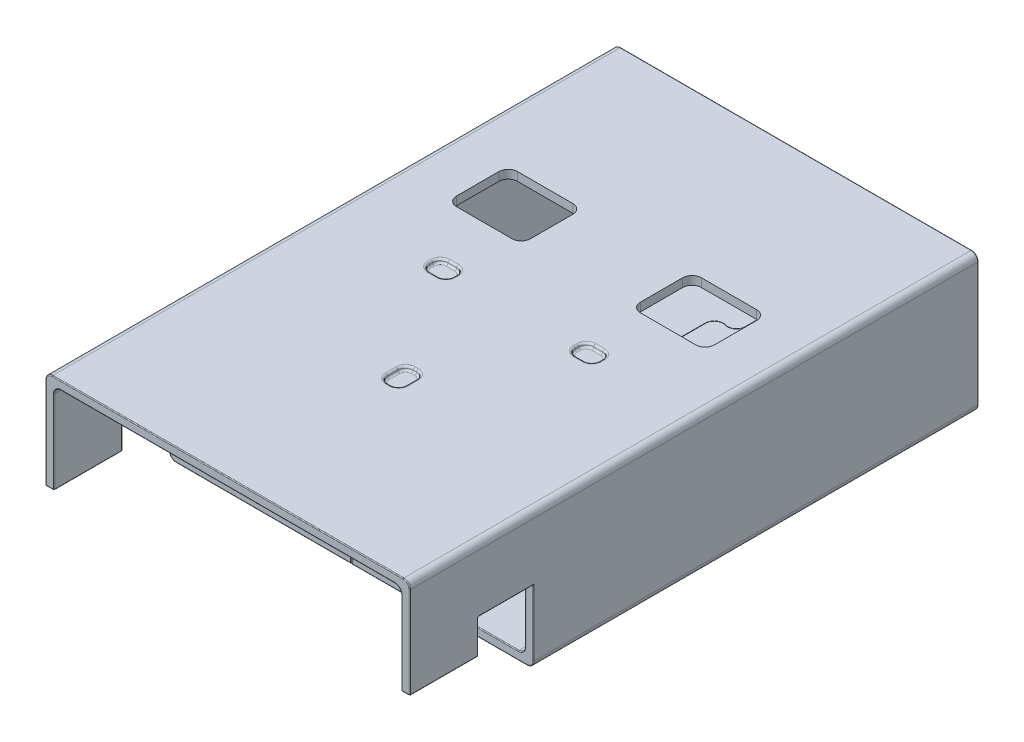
SolidWorks part; units mm, degrees
ref_plane "Front Plane" through (0, 0, 0) normal (0, 0, 1) x (1, 0, 0)
ref_plane "Top Plane" through (0, 0, 0) normal (0, 1, 0) x (1, 0, 0)
ref_plane "Right Plane" through (0, 0, 0) normal (1, 0, 0) x (0, 0, -1)
sketch "Sketch1" plane through (0, 0, 0) normal (0, 0, 1) x (1, 0, 0)
  line L1 (-6.0008, -2.2606) -> (6.0007, -2.2606)
  line L2 (-6.0008, -2.2606) -> (-6.0008, 2.2606)
  line L3 (-6.0008, 2.2606) -> (6.0007, 2.2606)
  line L4 (6.0007, -2.2606) -> (6.0007, 2.2606)
  line L5 (-6.0008, -2.2606) -> (6.0007, 2.2606) construction
  line L6 (-6.0008, 2.2606) -> (6.0007, -2.2606) construction
  point P0 (0, 0)
  point P6 (0, 0)
  dimension "D1" = 12.0015
  dimension "D2" = 4.5212
extrude "Extrude-Thin1" add sketch "Sketch1" along normal blind 18.7325 thin
sketch "Sketch2" plane through (0, 0, 0) normal (1, 0, 0) x (0, 0, -1)
  line L0 (-14.6558, -2.2606) -> (-14.6558, 0.1397)
  line L1 (-18.7325, -2.2606) -> (0, -2.2606) construction
  line L2 (-14.6558, 0.1397) -> (-16.4846, 0.1397)
  line L3 (-16.4846, 0.1397) -> (-16.4846, -0.9831)
  line L4 (-16.4846, -0.9831) -> (-18.7325, -0.9831)
  line L5 (-18.7325, 2.2606) -> (-18.7325, -2.2606) construction
  line L6 (-18.7325, -0.9831) -> (-18.7325, -2.2606)
  line L7 (-18.7325, -2.2606) -> (-14.6558, -2.2606)
  line L8 (0, 2.2606) -> (0, -2.2606) construction
  line L9 (-18.7325, 2.2606) -> (0, 2.2606) construction
  dimension "D1" = 14.6558
  dimension "D2" = 2.1209
  dimension "D3" = 2.2479
  dimension "D4" = 3.2437
extrude "Extrude1" cut sketch "Sketch2" against normal up to next and the other way up to next
sketch "Sketch3" plane through (0, -2.2606, 0) normal (0, -1, 0) x (1, 0, 0)
  line L0 (0, 0) -> (0, 1.6764)
  line L1 (-6.0008, 0) -> (6.0007, 0) construction
  line L2 (-0.762, 2.2352) -> (-0.762, 4.1148)
  line L3 (0, 6.35) -> (0, 4.6736)
  line L4 (-2.8416, 3.175) -> (2.0553, 3.175) construction
  line L5 (0, 7.874) -> (0, 9.5504)
  line L6 (-0.762, 10.1092) -> (-0.762, 11.9888)
  line L7 (0, 14.224) -> (0, 12.5476)
  line L8 (-2.8416, 11.049) -> (2.0553, 11.049) construction
  line L9 (-0.762, 3.175) -> (-0.762, 11.049) construction
  line L10 (0, 6.35) -> (0, 7.874)
  line L11 (0, 14.224) -> (0, 14.6558)
  line L12 (6.0007, 14.6558) -> (-6.0008, 14.6558) construction
  arc A0 (0, 1.6764) -> (-0.381, 1.9558) centre (-0.2929, 1.6764) ccw
  arc A1 (-0.381, 1.9558) -> (-0.762, 2.2352) centre (-0.4691, 2.2352) cw
  arc A2 (-0.381, 4.3942) -> (-0.762, 4.1148) centre (-0.4691, 4.1148) ccw
  arc A3 (0, 4.6736) -> (-0.381, 4.3942) centre (-0.2929, 4.6736) cw
  arc A4 (0, 9.5504) -> (-0.381, 9.8298) centre (-0.2929, 9.5504) ccw
  arc A5 (-0.381, 9.8298) -> (-0.762, 10.1092) centre (-0.4691, 10.1092) cw
  arc A6 (-0.381, 12.2682) -> (-0.762, 11.9888) centre (-0.4691, 11.9888) ccw
  arc A7 (0, 12.5476) -> (-0.381, 12.2682) centre (-0.2929, 12.5476) cw
  point P9 (-0.762, 3.175)
  point P25 (-0.762, 11.049)
  dimension "D1" = 0.5588
  dimension "D2" = 0.762
  dimension "D3" = 3.175
  dimension "D4" = 2.4384
  dimension "D5" = 7.874
extrude "Cut-Extrude-Thin1" cut sketch "Sketch3" against normal up to next thin
sketch "Sketch4" plane through (0, 2.2606, 0) normal (0, 1, 0) x (1, 0, 0)
  line L0 (0, 0) -> (0, -18.7325) construction
  line L1 (-3.9413, -5.2451) -> (-2.1166, -5.2451)
  line L2 (-4.2481, -5.5519) -> (-4.2481, -6.9449)
  line L3 (-3.9413, -7.2517) -> (-2.1166, -7.2517)
  line L4 (-1.8098, -5.5519) -> (-1.8098, -6.9449)
  line L5 (6.0007, -18.7325) -> (-6.0008, -18.7325) construction
  line L6 (1.8098, -5.5519) -> (1.8098, -6.9449)
  line L7 (3.9413, -7.2517) -> (2.1166, -7.2517)
  line L8 (4.2482, -5.5519) -> (4.2482, -6.9449)
  line L9 (3.9413, -5.2451) -> (2.1166, -5.2451)
  line L10 (6.0007, 0) -> (-6.0008, 0) construction
  line L11 (-6.0008, -18.7325) -> (-6.0008, 0) construction
  arc A0 (-3.9413, -5.2451) -> (-4.2481, -5.5519) centre (-3.9413, -5.5519) ccw
  arc A1 (-2.1166, -5.2451) -> (-1.8098, -5.5519) centre (-2.1166, -5.5519) cw
  arc A2 (-2.1166, -7.2517) -> (-1.8098, -6.9449) centre (-2.1166, -6.9449) ccw
  arc A3 (-4.2481, -6.9449) -> (-3.9413, -7.2517) centre (-3.9413, -6.9449) ccw
  arc A4 (4.2482, -6.9449) -> (3.9413, -7.2517) centre (3.9413, -6.9449) cw
  arc A5 (2.1166, -7.2517) -> (1.8098, -6.9449) centre (2.1166, -6.9449) cw
  arc A6 (2.1166, -5.2451) -> (1.8098, -5.5519) centre (2.1166, -5.5519) ccw
  arc A7 (3.9413, -5.2451) -> (4.2482, -5.5519) centre (3.9413, -5.5519) cw
  point P19 (-4.2482, -5.2451)
  point P22 (-1.8098, -5.2451)
  point P25 (-1.8098, -7.2517)
  point P28 (-4.2482, -7.2517)
  point P37 (4.2481, -7.2517)
  point P38 (1.8097, -7.2517)
  point P39 (1.8098, -5.2451)
  point P40 (4.2481, -5.2451)
  dimension "D5" = 0.3068
  dimension "D1" = 2.4384
  dimension "D2" = 2.0066
  dimension "D3" = 5.2451
  dimension "D4" = 1.7526
extrude "Extrude2" cut sketch "Sketch4" against normal through all
fillet "Fillet1" radius 0.2195 8 edges at (-6.0008, -2.2606, 7.3279) (6.0007, -2.2606, 7.3279) (6.0007, 2.2606, 9.3662) (-6.0008, 2.2606, 9.3662) (-5.7214, 1.9812, 9.3662) (-5.7214, -1.9812, 7.3279) (5.7213, -1.9812, 7.3279) (5.7213, 1.9812, 9.3662)
sketch "Sketch5" plane through (0, 2.2606, 0) normal (0, 1, 0) x (1, 0, 0)
  line L0 (0, 0) -> (0, -18.7325) construction
  line L1 (-2.5464, -8.9281) -> (-2.2585, -8.9281)
  line L2 (-2.8004, -9.1821) -> (-2.8004, -9.2837)
  line L3 (-2.5464, -9.5377) -> (-2.2585, -9.5377)
  line L4 (-2.0045, -9.1821) -> (-2.0045, -9.2837)
  line L5 (5.7813, -18.7325) -> (-5.7813, -18.7325) construction
  line L6 (-6.0008, -18.7325) -> (-6.0008, 0) construction
  line L7 (-0.055, -12.5645) -> (0.055, -12.5645)
  line L8 (-0.309, -12.8185) -> (-0.309, -13.1572)
  line L9 (-0.055, -13.4112) -> (0.055, -13.4112)
  line L10 (0.309, -12.8185) -> (0.309, -13.1572)
  line L11 (-0.309, -12.5645) -> (0.309, -13.4112) construction
  line L12 (-0.309, -13.4112) -> (0.309, -12.5645) construction
  line L13 (-3.9413, -7.2517) -> (-2.1166, -7.2517) construction
  line L14 (2.0045, -9.1821) -> (2.0045, -9.2837)
  line L15 (2.5464, -9.5377) -> (2.2585, -9.5377)
  line L16 (2.8004, -9.1821) -> (2.8004, -9.2837)
  line L17 (2.5464, -8.9281) -> (2.2585, -8.9281)
  arc A0 (-2.5464, -8.9281) -> (-2.8004, -9.1821) centre (-2.5464, -9.1821) ccw
  arc A1 (-2.2585, -8.9281) -> (-2.0045, -9.1821) centre (-2.2585, -9.1821) cw
  arc A2 (-2.2585, -9.5377) -> (-2.0045, -9.2837) centre (-2.2585, -9.2837) ccw
  arc A3 (-2.8004, -9.2837) -> (-2.5464, -9.5377) centre (-2.5464, -9.2837) ccw
  arc A4 (-0.055, -12.5645) -> (-0.309, -12.8185) centre (-0.055, -12.8185) ccw
  arc A5 (0.055, -12.5645) -> (0.309, -12.8185) centre (0.055, -12.8185) cw
  arc A6 (0.055, -13.4112) -> (0.309, -13.1572) centre (0.055, -13.1572) ccw
  arc A7 (-0.309, -13.1572) -> (-0.055, -13.4112) centre (-0.055, -13.1572) ccw
  arc A8 (2.8004, -9.2837) -> (2.5464, -9.5377) centre (2.5464, -9.2837) cw
  arc A9 (2.2585, -9.5377) -> (2.0045, -9.2837) centre (2.2585, -9.2837) cw
  arc A10 (2.2585, -8.9281) -> (2.0045, -9.1821) centre (2.2585, -9.1821) ccw
  arc A11 (2.5464, -8.9281) -> (2.8004, -9.1821) centre (2.5464, -9.1821) cw
  point P9 (0, -12.9879)
  point P22 (-2.0045, -8.9281)
  point P25 (-2.0045, -9.5377)
  point P28 (-2.8004, -9.5377)
  point P53 (2.8004, -9.5377)
  point P54 (2.0045, -9.5377)
  point P55 (2.0045, -8.9281)
  dimension "D8" = 0.254
  dimension "D1" = 0.8467
  dimension "D2" = 5.3213
  dimension "D3" = 0.6181
  dimension "D4" = 3.2004
  dimension "D5" = 1.6764
  dimension "D6" = 0.6096
  dimension "D7" = 0.7959
extrude "Extrude3" cut sketch "Sketch5" against normal blind 0.127
fillet "Fillet3" radius 0.0635 48 edges at (0.309, 2.1336, 12.9879) (0.2346, 2.1336, 13.3368) (0, 2.1336, 13.4112) (-0.2346, 2.1336, 13.3368) (-0.309, 2.1336, 12.9879) (-0.2346, 2.1336, 12.6389) (0, 2.1336, 12.5645) (0.309, 2.2606, 12.9879) (0.2346, 2.2606, 13.3368) (0, 2.2606, 13.4112) (-0.2346, 2.2606, 13.3368) (-0.309, 2.2606, 12.9879) (-0.2346, 2.2606, 12.6389) (0, 2.2606, 12.5645) (2.726, 2.2606, 9.0025) (2.8004, 2.2606, 9.2329) (2.726, 2.2606, 9.4633) (2.4024, 2.2606, 9.5377) (2.0789, 2.2606, 9.4633) (2.0045, 2.2606, 9.2329) (2.0789, 2.2606, 9.0025) (2.726, 2.1336, 9.0025) (2.8004, 2.1336, 9.2329) (2.726, 2.1336, 9.4633) (2.4024, 2.1336, 9.5377) (2.0789, 2.1336, 9.4633) (2.0045, 2.1336, 9.2329) (2.0789, 2.1336, 9.0025) (-2.0045, 2.1336, 9.2329) (-2.0789, 2.1336, 9.4633) (-2.4024, 2.1336, 9.5377) (-2.726, 2.1336, 9.4633) (-2.8004, 2.1336, 9.2329) (-2.726, 2.1336, 9.0025) (-2.4024, 2.1336, 8.9281) (-2.0789, 2.2606, 9.0025) (-2.0045, 2.2606, 9.2329) (-2.0789, 2.2606, 9.4633) (-2.4024, 2.2606, 9.5377) (-2.726, 2.2606, 9.4633) (-2.8004, 2.2606, 9.2329) (-2.726, 2.2606, 9.0025) (0.2346, 2.1336, 12.6389) (0.2346, 2.2606, 12.6389) (2.4024, 2.2606, 8.9281) (2.4024, 2.1336, 8.9281) (-2.0789, 2.1336, 9.0025) (-2.4024, 2.2606, 8.9281)
sketch "Sketch6" plane through (0, -2.2606, 0) normal (0, -1, 0) x (1, 0, 0)
  line L12 (-0.0444, 2.2162) -> (-0.0444, 4.1338)
  line L13 (-0.0444, 10.0902) -> (-0.0444, 12.0078)
  line L20 (0.1333, 0.127) -> (5.6543, 0.127)
  line L21 (5.6543, 0.127) -> (5.6543, 14.5288)
  line L22 (5.6543, 14.5288) -> (0.1334, 14.5288)
  line L23 (0.1334, 14.5288) -> (0.1333, 12.5476)
  line L24 (-0.6287, 11.9888) -> (-0.6287, 10.1092)
  line L25 (0.1333, 9.5504) -> (0.1333, 4.6736)
  line L26 (-0.6286, 4.1148) -> (-0.6287, 2.2352)
  line L27 (0.1334, 1.6764) -> (0.1333, 0.127)
  line L32 (-0.6287, 11.9888) -> (-0.6287, 10.1092)
  line L34 (-0.6286, 4.1148) -> (-0.6287, 2.2352)
  arc A24 (-0.0444, 2.2162) -> (-0.1993, 2.0923) centre (-0.1714, 2.2162) cw
  arc A25 (-0.0444, 4.1338) -> (-0.1993, 4.2577) centre (-0.1714, 4.1338) ccw
  arc A26 (-0.0444, 12.0078) -> (-0.1993, 12.1317) centre (-0.1714, 12.0078) ccw
  arc A27 (-0.0444, 10.0902) -> (-0.1993, 9.9663) centre (-0.1714, 10.0902) cw
  arc A32 (-0.4211, 12.141) -> (0.1333, 12.5476) centre (-0.2929, 12.5476) ccw
  arc A33 (-0.4211, 12.141) -> (-0.6287, 11.9888) centre (-0.4691, 11.9888) ccw
  arc A34 (-0.6287, 10.1092) -> (-0.4211, 9.957) centre (-0.4691, 10.1092) ccw
  arc A35 (0.1333, 9.5504) -> (-0.4211, 9.957) centre (-0.2929, 9.5504) ccw
  arc A36 (-0.4211, 4.267) -> (0.1333, 4.6736) centre (-0.2929, 4.6736) ccw
  arc A37 (-0.4211, 4.267) -> (-0.6286, 4.1148) centre (-0.4691, 4.1148) ccw
  arc A38 (-0.6287, 2.2352) -> (-0.4211, 2.083) centre (-0.4691, 2.2352) ccw
  arc A39 (0.1334, 1.6764) -> (-0.4211, 2.083) centre (-0.2929, 1.6764) ccw
  arc A40 (-0.4211, 12.141) -> (-0.1993, 12.1317) centre (-0.2929, 12.5476) ccw
  arc A41 (-0.4211, 12.141) -> (-0.6287, 11.9888) centre (-0.4691, 11.9888) ccw
  arc A42 (-0.6287, 10.1092) -> (-0.4211, 9.957) centre (-0.4691, 10.1092) ccw
  arc A43 (-0.1993, 9.9663) -> (-0.4211, 9.957) centre (-0.2929, 9.5504) ccw
  arc A44 (-0.4211, 4.267) -> (-0.1993, 4.2577) centre (-0.2929, 4.6736) ccw
  arc A45 (-0.4211, 4.267) -> (-0.6286, 4.1148) centre (-0.4691, 4.1148) ccw
  arc A46 (-0.6287, 2.2352) -> (-0.4211, 2.083) centre (-0.4691, 2.2352) ccw
  arc A47 (-0.1993, 2.0923) -> (-0.4211, 2.083) centre (-0.2929, 1.6764) ccw
  dimension "D2" = 0.127
  dimension "D3" = 0.5842
  dimension "D1" = 0.127
extrude "Extrude4" cut sketch "Sketch6" against normal blind 0.0508
fillet "Fillet4" radius 0.0254 32 edges at (-0.5634, -2.2606, 4.2435) (-0.3108, -2.2606, 4.2477) (-0.0921, -2.2606, 4.233) (-0.0444, -2.2606, 3.175) (-0.0921, -2.2606, 2.117) (-0.3108, -2.2606, 2.1023) (-0.5634, -2.2606, 2.1065) (-0.5634, -2.2606, 12.1175) (-0.3108, -2.2606, 12.1217) (-0.0921, -2.2606, 12.107) (-0.0444, -2.2606, 11.049) (-0.0921, -2.2606, 9.991) (-0.3108, -2.2606, 9.9763) (-0.5634, -2.2606, 9.9805) (-0.3108, -2.2098, 2.1023) (-0.5634, -2.2098, 2.1065) (-0.6287, -2.2098, 3.175) (-0.5634, -2.2098, 4.2435) (-0.3108, -2.2098, 4.2477) (-0.0921, -2.2098, 4.233) (-0.0444, -2.2098, 3.175) (-0.0921, -2.2098, 2.117) (-0.0444, -2.2098, 11.049) (-0.0921, -2.2098, 9.991) (-0.3108, -2.2098, 9.9763) (-0.5634, -2.2098, 9.9805) (-0.6287, -2.2098, 11.049) (-0.5634, -2.2098, 12.1175) (-0.3108, -2.2098, 12.1217) (-0.0921, -2.2098, 12.107) (-0.6287, -2.2606, 3.175) (-0.6287, -2.2606, 11.049)
fillet "Fillet5" radius 0.0254 26 edges at (-0.0064, -2.2606, 13.6017) (-0.1235, -2.2606, 12.3165) (-0.646, -2.2606, 12.2302) (-0.7684, -2.2606, 11.049) (-0.646, -2.2606, 9.8678) (-0.1235, -2.2606, 9.7815) (-0.0064, -2.2606, 7.112) (-0.1235, -2.2606, 4.4425) (-0.646, -2.2606, 4.3562) (-0.7684, -2.2606, 3.175) (-0.646, -2.2606, 1.9938) (-0.1235, -2.2606, 1.9075) (0.0063, -2.2606, 13.6017) (-0.116, -2.2606, 12.3062) (-0.6385, -2.2606, 12.2199) (-0.7557, -2.2606, 11.049) (-0.6385, -2.2606, 9.8781) (-0.116, -2.2606, 9.7918) (0.0063, -2.2606, 7.112) (-0.116, -2.2606, 4.4322) (-0.6385, -2.2606, 4.3459) (-0.7557, -2.2606, 3.175) (-0.6385, -2.2606, 2.0041) (-0.116, -2.2606, 1.9178) (-0.0064, -2.2606, 0.8382) (0.0063, -2.2606, 0.8382)
fillet "Fillet6" radius 0.0254 100 edges at (2.7541, -1.9812, 0) (5.6571, -1.9169, 0) (-2.7541, -1.9812, 0) (-5.6571, -1.9169, 0) (-5.7214, 0, 0) (-5.6571, 1.9169, 0) (0, 1.9812, 0) (5.6571, 1.9169, 0) (0.0063, -2.1082, 0) (0.0138, -2.2532, 0) (2.9065, -2.2606, 0) (5.9365, -2.1963, 0) (-0.0064, -2.1082, 0) (-0.0138, -2.2532, 0) (-2.9065, -2.2606, 0) (-5.9365, -2.1963, 0) (-6.0008, 0, 0) (-5.9365, 2.1963, 0) (0, 2.2606, 0) (5.9365, 2.1963, 0) (5.7213, 0, 0) (6.0007, 0, 0) (5.7213, -0.811, 14.6558) (5.6571, -1.9169, 14.6558) (-2.7541, -1.9812, 14.6558) (-5.6571, -1.9169, 14.6558) (-0.0064, -2.1082, 14.6558) (-0.0138, -2.2532, 14.6558) (-6.0008, -0.9507, 14.6558) (-5.9365, -2.1963, 14.6558) (5.7213, 0.3893, 18.7325) (5.6571, 1.9169, 18.7325) (-5.7214, 0.3893, 18.7325) (-5.6571, 1.9169, 18.7325) (-6.0008, 0.529, 18.7325) (-5.9365, 2.1963, 18.7325) (0, 2.2606, 18.7325) (5.9365, 2.1963, 18.7325) (6.0007, -0.9507, 14.6558) (5.9365, -2.1963, 14.6558) (0.0063, -2.1082, 14.6558) (0.0138, -2.2532, 14.6558) (-4.1583, -1.9812, 7.1618) (-4.2482, -1.9812, 6.2484) (-4.1583, -1.9812, 5.335) (-3.029, -1.9812, 5.2451) (-1.8996, -1.9812, 5.335) (-1.8098, -1.9812, 6.2484) (-1.8996, -1.9812, 7.1618) (-4.1583, -2.2606, 7.1618) (-4.2481, -2.2606, 6.2484) (-4.1583, -2.2606, 5.335) (-3.029, -2.2606, 5.2451) (-1.8996, -2.2606, 5.335) (-1.8098, -2.2606, 6.2484) (-1.8996, -2.2606, 7.1618) (1.8996, -1.9812, 7.1618) (1.8098, -1.9812, 6.2484) (1.8996, -1.9812, 5.335) (3.029, -1.9812, 5.2451) (4.1583, -1.9812, 5.335) (4.2482, -1.9812, 6.2484) (4.1583, -1.9812, 7.1618) (1.8996, -2.2606, 7.1618) (1.8098, -2.2606, 6.2484) (1.8996, -2.2606, 5.335) (3.029, -2.2606, 5.2451) (4.1583, -2.2606, 5.335) (4.2482, -2.2606, 6.2484) (4.1583, -2.2606, 7.1618) (-5.8611, -0.9831, 18.7325) (5.861, -0.9831, 18.7325) (5.861, 0.1397, 14.6558) (5.861, -0.9831, 16.4846) (5.861, 0.1397, 16.4846) (-5.8611, 0.1397, 14.6558) (-5.8611, 0.1397, 16.4846) (-5.8611, -0.9831, 16.4846) (-6.0008, -0.9831, 17.6086) (-6.0008, -0.4217, 16.4846) (-6.0008, 0.1397, 15.5702) (5.7213, -0.4217, 16.4846) (5.7213, 0.1397, 15.5702) (2.7541, -1.9812, 14.6558) (-5.7214, -0.811, 14.6558) (-5.7214, 0.1397, 15.5702) (-5.7214, -0.4217, 16.4846) (-5.7214, -0.9831, 17.6086) (-2.9065, -2.2606, 14.6558) (5.7213, -0.9831, 17.6086) (6.0007, -0.9831, 17.6086) (0, 1.9812, 18.7325) (6.0007, 0.529, 18.7325) (6.0007, -0.4217, 16.4846) (6.0007, 0.1397, 15.5702) (2.9065, -2.2606, 14.6558) (-3.029, -1.9812, 7.2517) (-3.029, -2.2606, 7.2517) (3.029, -1.9812, 7.2517) (3.029, -2.2606, 7.2517)
